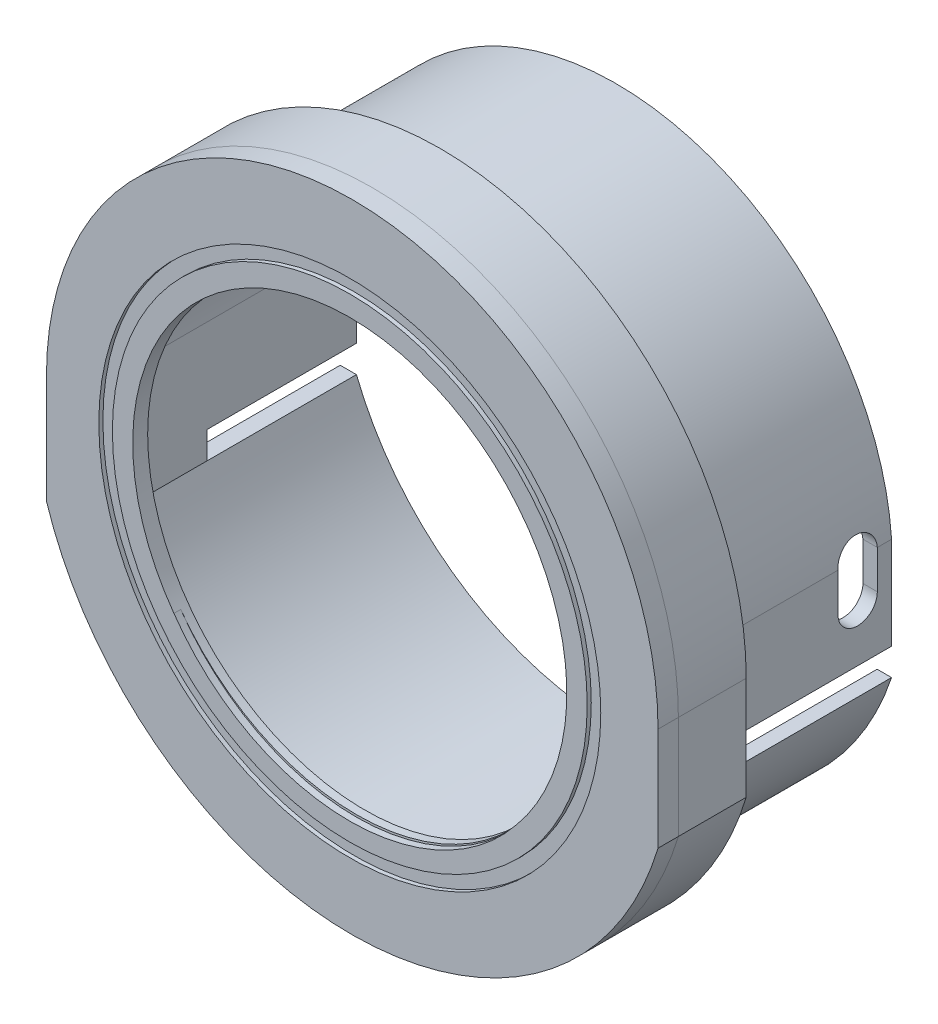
SolidWorks part; units mm, degrees
ref_plane "Front Plane" through (0, 0, 0) normal (0, 0, 1) x (1, 0, 0)
ref_plane "Top Plane" through (0, 0, 0) normal (0, 1, 0) x (1, 0, 0)
ref_plane "Right Plane" through (0, 0, 0) normal (1, 0, 0) x (0, 0, -1)
sketch "草图1" plane through (0, 0, 0) normal (0, 0, 1) x (1, 0, 0)
  line L16 (-23.2207, -1.2625) -> (-23.2207, -9.2462)
  line L18 (21.8612, -1.2625) -> (21.8612, -8.8618)
  arc A5 (-23.2207, -1.2625) -> (21.8612, -1.2625) centre (-0.6797, -1.2625) cw
  arc A6 (-23.2207, -9.2462) -> (21.8612, -8.8618) centre (-0.7393, -2.0647) ccw
extrude "凸台-拉伸1" add sketch "草图1" along normal blind 1.5
sketch "草图2" plane through (0, 0, 0) normal (0, 0, -1) x (-1, 0, 0)
  line L7 (-10.89, -2.3374) -> (-5.015, -12.5132)
  line L8 (-5.015, -12.5132) -> (6.735, -12.5132)
  line L9 (6.735, -12.5132) -> (12.61, -2.3374)
  line L10 (12.61, -2.3374) -> (6.735, 7.8384)
  line L11 (6.735, 7.8384) -> (-5.015, 7.8384)
  line L12 (-5.015, 7.8384) -> (-10.89, -2.3374)
  circle A1 centre (0.86, -2.3374) radius 10.1758 construction
extrude "切除-拉伸1" cut sketch "草图2" against normal blind 1.5
sketch "草图11" plane through (0, 0, 1.5) normal (0, 0, 1) x (1, 0, 0)
  circle A0 centre (-0.8747, -2.7494) radius 15
  circle A1 centre (-0.8747, -2.7494) radius 15.75
  dimension "D1" = 0.75
extrude "切除-拉伸12" cut sketch "草图11" against normal blind 0.5
sketch "草图20" plane through (0, 0, 0) normal (0, 0, -1) x (-1, 0, 0)
  line L1 (-18.5112, -8.8618) -> (-18.5112, -0.0325)
  line L2 (19.8704, -0.3844) -> (19.8704, -9.2462)
  line L4 (-19.5747, -0.0325) -> (-19.5747, -8.8618)
  line L5 (21.066, -0.3844) -> (21.066, -9.2462)
  arc A0 (-18.5112, -0.0325) -> (19.8704, -0.3844) centre (0.6676, -1.5127) cw
  arc A1 (-18.5112, -8.8618) -> (19.8704, -9.2462) centre (0.7537, -1.6484) ccw
  arc A4 (-19.5747, -0.0325) -> (21.066, -0.3844) centre (0.7348, -1.458) cw
  arc A5 (-19.5747, -8.8618) -> (21.066, -9.2462) centre (0.8114, -2.0968) ccw
  dimension "D2" = 0
  dimension "D4" = 0
  dimension "D5" = 3.35
extrude "凸台-拉伸2" add sketch "草图20" along normal blind 15
sketch "草图21" plane through (0, 0, 0) normal (0, 0, -1) x (-1, 0, 0)
  line L0 (-21.8612, -1.2625) -> (-21.8612, -8.8618)
  line L1 (-21.2442, -8.8618) -> (-21.2442, -1.2625)
  line L2 (22.428, -1.2625) -> (22.428, -9.2462)
  line L3 (23.2207, -1.2625) -> (23.2207, -9.2462)
  arc A0 (-21.8612, -1.2625) -> (23.2207, -1.2625) centre (0.6797, -1.2625) cw
  arc A1 (-21.8612, -8.8618) -> (23.2207, -9.2462) centre (0.7393, -2.0647) ccw
  arc A2 (-21.2442, -1.2625) -> (22.428, -1.2625) centre (0.5919, -1.7238) cw
  arc A3 (-21.2442, -8.8618) -> (22.428, -9.2462) centre (0.6576, -1.5849) ccw
extrude "凸台-拉伸3" add sketch "草图21" along normal blind 5
sketch "草图22" plane through (0, 0, -15) normal (0, 0, -1) x (-1, 0, 0)
  line L0 (-19.5747, -0.0325) -> (-19.5747, -8.8618) construction
  line L1 (-19.5747, -6.8618) -> (-18.5112, -6.8618)
  line L2 (-19.5747, -6.8618) -> (-19.5747, -8.8618)
  line L3 (-19.5747, -8.8618) -> (-18.5112, -8.8618)
  line L4 (-18.5112, -6.8618) -> (-18.5112, -8.8618)
  line L5 (-18.5112, -0.0325) -> (-18.5112, -8.8618) construction
  line L6 (-18.5112, -0.0325) -> (-18.5112, -8.8618) construction
  line L12 (19.8704, -9.2462) -> (19.8704, -0.3844) construction
  line L13 (21.066, -9.2462) -> (19.8704, -9.2462)
  line L14 (21.066, -9.2462) -> (21.066, -7.2462)
  line L15 (21.066, -7.2462) -> (19.8704, -7.2462)
  line L16 (19.8704, -9.2462) -> (19.8704, -7.2462)
  dimension "D1" = 2
  dimension "D2" = 2
extrude "切除-拉伸13" cut sketch "草图22" against normal blind 11
sketch "草图23" plane through (19.5747, 0, 0) normal (1, 0, 0) x (0, 0, -1)
  line L0 (15, -0.0325) -> (0, -0.0325) construction
  line L3 (11.05, -0.0325) -> (11.05, -2.8618)
  line L4 (13.95, -2.8618) -> (13.95, -0.0325)
  arc A1 (11.05, -2.8618) -> (13.95, -2.8618) centre (12.5, -2.8618) ccw
  arc A2 (11.05, -0.0325) -> (13.95, -0.0325) centre (12.5, -0.0325) cw
extrude "切除-拉伸14" cut sketch "草图23" against normal blind 3
sketch "草图24" plane through (-21.066, 0, 0) normal (-1, 0, 0) x (0, 0, 1)
  line L0 (1.5, -1.2625) -> (1.5, -9.2462) construction
  line L1 (-4, -7.2462) -> (-15, -7.2462) construction
  circle A0 centre (-12.5, -1.2462) radius 1.45
  dimension "D1" = 14
  dimension "D2" = 6
extrude "切除-拉伸15" cut sketch "草图24" against normal blind 3
sketch "草图25" plane through (0, 0, 0) normal (0, 0, -1) x (-1, 0, 0)
  line L0 (-13.2716, -2.6335) -> (-6.7297, 9.4613)
  line L1 (8.1247, 9.7952) -> (14.7429, -2.1061)
  line L2 (7.7173, -14.703) -> (-5.8844, -14.703)
  arc A0 (-6.7297, 9.4613) -> (8.1247, 9.7952) centre (0.9396, -1.1458) cw
  arc A1 (14.7429, -2.1061) -> (7.7173, -14.703) centre (1.4112, -2.9282) cw
  arc A2 (-5.8844, -14.703) -> (-13.2716, -2.6335) centre (0.6153, -2.4293) cw
  dimension "D1" = 2.4
  dimension "D2" = 2.4
  dimension "D3" = 2.4
extrude "切除-拉伸16" cut sketch "草图25" against normal blind 0.4
sketch "草图26" plane through (0, 0, 0) normal (0, 0, -1) x (-1, 0, 0)
  line L0 (-19.5747, -0.0325) -> (-19.5747, -6.8618) construction
  line L1 (21.066, -7.2462) -> (21.066, -0.3844) construction
  line L2 (-21.2442, -1.2625) -> (-21.2442, -8.8618)
  line L3 (-19.5747, -1.2625) -> (-19.5747, -8.8618)
  line L4 (21.066, -1.2625) -> (21.066, -9.2462)
  line L5 (22.428, -1.2625) -> (22.428, -9.2462)
  arc A0 (-21.2442, -1.2625) -> (22.428, -1.2625) centre (0.5919, -1.7238) cw
  arc A1 (-21.2442, -8.8618) -> (22.428, -9.2462) centre (0.6576, -1.5849) ccw
  arc A2 (-19.5747, -8.8618) -> (21.066, -9.2462) centre (0.8114, -2.0968) ccw
  arc A3 (-19.5747, -1.2625) -> (21.066, -1.2625) centre (0.7456, -1.421) cw
extrude "切除-拉伸17" cut sketch "草图26" against normal blind 1.15
sketch "草图27" plane through (18.5112, 0, 0) normal (-1, 0, 0) x (0, 0, 1)
  line L0 (0, 22.1862) -> (0, -27.829)
split "分割1" trim tools "草图27" bodies to split 129 resulting bodies 130 131 132
move or copy body "实体-移动/复制1" bodies to move or copy 130 copy no translate (0, 0, -3) parameters "D1"=0, "D2"=0, "D3"=3
sketch "草图28" plane through (0, 0, -3) normal (0, 0, 1) x (1, 0, 0)
  line L0 (-21.066, -9.2462) -> (-21.066, -0.3844) construction
  line L1 (-21.066, -9.2462) -> (-21.066, -0.3844)
  line L2 (19.5747, -0.0325) -> (19.5747, -8.8618) construction
  line L3 (19.5747, -0.0325) -> (19.5747, -8.8618)
  line L4 (-19.8704, -9.2462) -> (-19.8704, -0.3844) construction
  line L5 (-19.8704, -9.2462) -> (-19.8704, -0.3844)
  line L6 (18.5112, -0.0325) -> (18.5112, -8.8618) construction
  line L7 (18.5112, -0.0325) -> (18.5112, -8.8618)
  arc A0 (19.5747, -0.0325) -> (-21.066, -0.3844) centre (-0.7348, -1.458) ccw construction
  arc A1 (19.5747, -0.0325) -> (-21.066, -0.3844) centre (-0.7348, -1.458) ccw
  arc A2 (-21.066, -9.2462) -> (19.5747, -8.8618) centre (-0.8114, -2.0968) ccw construction
  arc A3 (-21.066, -9.2462) -> (19.5747, -8.8618) centre (-0.8114, -2.0968) ccw
  arc A4 (18.5112, -0.0325) -> (-19.8704, -0.3844) centre (-0.6676, -1.5127) ccw construction
  arc A5 (18.5112, -0.0325) -> (-19.8704, -0.3844) centre (-0.6676, -1.5127) ccw
  arc A6 (-19.8704, -9.2462) -> (18.5112, -8.8618) centre (-0.7537, -1.6484) ccw construction
  arc A7 (-19.8704, -9.2462) -> (18.5112, -8.8618) centre (-0.7537, -1.6484) ccw
extrude "凸台-拉伸4" add sketch "草图28" along normal blind 3
sketch "草图29" plane through (0, 0, 1.5) normal (0, 0, 1) x (1, 0, 0)
  line L0 (-6.735, 7.8384) -> (5.015, -12.5132)
  line L1 (5.015, 7.8384) -> (-6.735, -12.5132)
  point P8 (-0.86, -2.3374)
sketch "草图30" plane through (0, 0, 1.5) normal (0, 0, 1) x (1, 0, 0)
  circle A0 centre (-0.86, -2.3374) radius 16
extrude "切除-拉伸18" cut sketch "草图30" against normal blind 10
sketch "草图31" plane through (0, 0, 1.5) normal (0, 0, 1) x (1, 0, 0)
  circle A0 centre (-0.86, -2.3374) radius 17.5
  circle A1 centre (-0.86, -2.3374) radius 18.5
extrude "切除-拉伸19" cut sketch "草图31" against normal blind 0.3 contours A1 | A0
sketch "草图32" plane through (0, 0, 0) normal (0, 0, -1) x (-1, 0, 0)
  circle A0 centre (0.86, -2.3374) radius 19
extrude "切除-拉伸20" cut sketch "草图32" against normal blind 0.4
